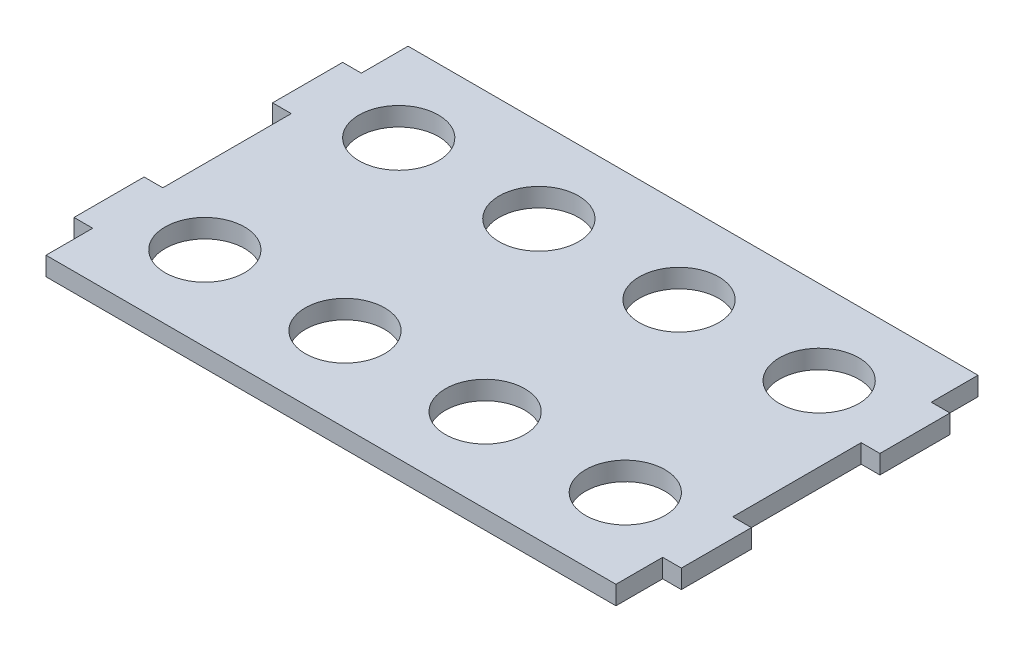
SolidWorks part; units mm, degrees
ref_plane "Ebene vorne" through (0, 0, 0) normal (0, 0, 1) x (1, 0, 0)
ref_plane "Ebene oben" through (0, 0, 0) normal (0, 1, 0) x (1, 0, 0)
ref_plane "Ebene rechts" through (0, 0, 0) normal (1, 0, 0) x (0, 0, -1)
sketch "Skizze2" plane through (0, 0, 0) normal (0, 1, 0) x (1, 0, 0)
  line L0 (-74.6062, 0) -> (112.5525, 0) construction
  line L1 (0, 76.8215) -> (0, -83.6429) construction
  line L2 (-65, -20.75) -> (65, -20.75) construction
  line L3 (-61, 38.75) -> (61, 38.75)
  line L4 (-61, -28.75) -> (-61, -38.75)
  line L5 (-61, -38.75) -> (61, -38.75)
  line L6 (65, 28.75) -> (65, 13.75)
  line L7 (-69.1447, -8) -> (72.5547, -8) construction
  line L8 (65, -30.75) -> (-65, -30.75) construction
  line L9 (61, 38.75) -> (61, 28.75)
  line L10 (61, 28.75) -> (65, 28.75)
  line L11 (61, 13.75) -> (65, 13.75)
  line L12 (61, -28.75) -> (61, -38.75)
  line L13 (61, -13.75) -> (65, -13.75)
  line L14 (61, -28.75) -> (65, -28.75)
  line L15 (65, -28.75) -> (65, -13.75)
  line L16 (61, 13.75) -> (61, -13.75)
  line L17 (-61, 28.75) -> (-65, 28.75)
  line L18 (-65, 28.75) -> (-65, 13.75)
  line L19 (-61, -13.75) -> (-65, -13.75)
  line L20 (-65, -28.75) -> (-65, -13.75)
  line L21 (-61, 38.75) -> (-61, 28.75)
  line L22 (-61, 13.75) -> (-61, -13.75)
  line L23 (-65, 13.75) -> (-61, 13.75)
  line L24 (-65, -28.75) -> (-61, -28.75)
  circle A0 centre (-45, -20.75) radius 8.5
  circle A1 centre (-45, -20.75) radius 12.5 construction
  circle A2 centre (-15, -20.75) radius 8.5
  circle A3 centre (-15, -20.75) radius 12.5 construction
  circle A4 centre (45, -20.75) radius 8.5
  circle A5 centre (45, -20.75) radius 12.5 construction
  circle A6 centre (15, -20.75) radius 12.5 construction
  circle A7 centre (15, -20.75) radius 8.5
  circle A8 centre (45, 20.75) radius 12.5 construction
  circle A9 centre (45, 20.75) radius 8.5
  circle A10 centre (15, 20.75) radius 8.5
  circle A11 centre (15, 20.75) radius 12.5 construction
  circle A12 centre (-45, 20.75) radius 12.5 construction
  circle A13 centre (-15, 20.75) radius 12.5 construction
  circle A14 centre (-15, 20.75) radius 8.5
  circle A15 centre (-45, 20.75) radius 8.5
  dimension "D3" = 17
  dimension "D5" = 25
  dimension "D2" = 130
  dimension "D4" = 18
  dimension "D6" = 8
  dimension "D7" = 8
  dimension "D8" = 30
  dimension "D9" = 30
  dimension "D10" = 4
  dimension "D11" = 10
  dimension "D12" = 15
  dimension "D13" = 77.5
extrude "Aufsatz-Linear austragen1" add sketch "Skizze2" along normal blind 4
